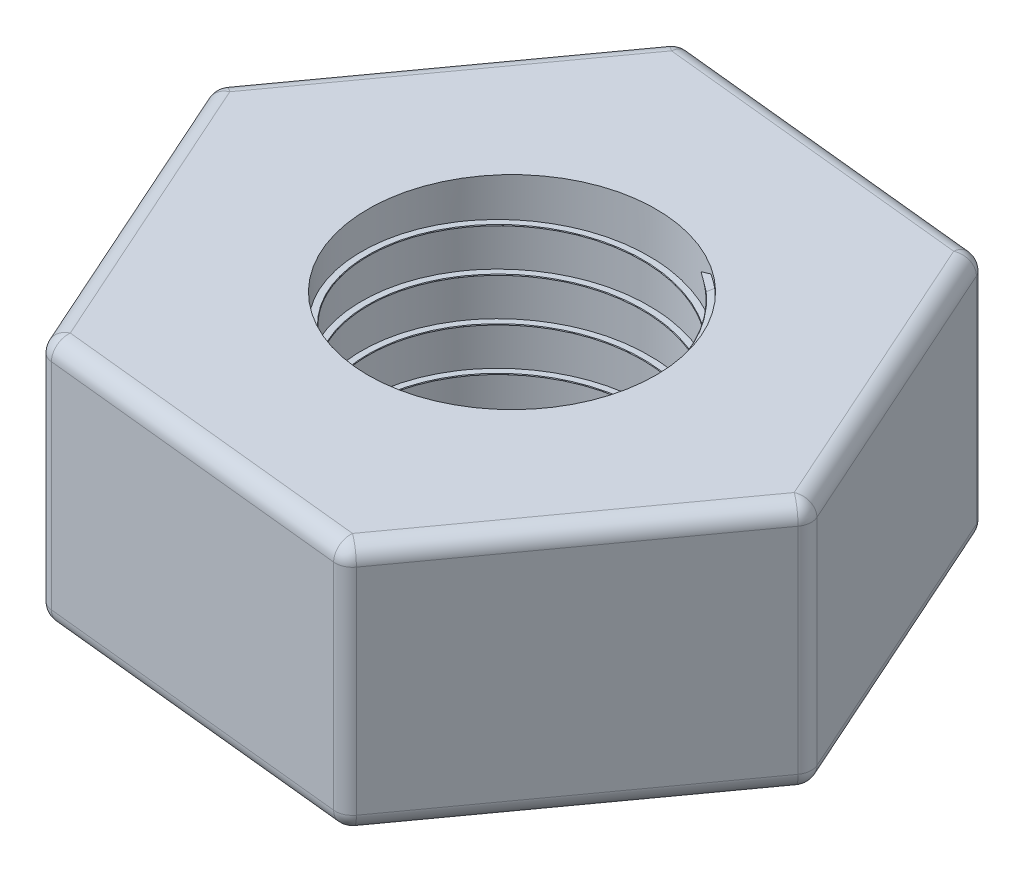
SolidWorks part; units mm, degrees
ref_plane "Front Plane" through (0, 0, 0) normal (0, 0, 1) x (1, 0, 0)
ref_plane "Top Plane" through (0, 0, 0) normal (0, 1, 0) x (1, 0, 0)
ref_plane "Right Plane" through (0, 0, 0) normal (1, 0, 0) x (0, 0, -1)
sketch "Sketch1" plane through (0, 0, 0) normal (0, 1, 0) x (1, 0, 0)
  line L1 (1.6237, -3.6273) -> (3.9532, -0.4075)
  line L2 (3.9532, -0.4075) -> (2.3295, 3.2198)
  line L3 (2.3295, 3.2198) -> (-1.6237, 3.6273)
  line L4 (-1.6237, 3.6273) -> (-3.9532, 0.4075)
  line L5 (-3.9532, 0.4075) -> (-2.3295, -3.2198)
  line L6 (-2.3295, -3.2198) -> (1.6237, -3.6273)
  circle A0 centre (0, 0) radius 3.4417 construction
  circle A1 centre (0, 0) radius 1.7018
  dimension "D2" = 3.4036
  dimension "D1" = 6.8834
extrude "Boss-Extrude1" add sketch "Sketch1" along normal blind 2.9464
sketch "Sketch2" plane through (0, 0, 0) normal (0, -1, 0) x (1, 0, 0)
  circle A2 centre (0, 0) radius 1.9558
  circle A3 centre (0, 0) radius 1.9558
  dimension "D1" = 0.254
curve "Helix/Spiral1"
sketch "Sketch3" plane through (0, 0, 0) normal (0, -1, 0) x (1, 0, 0)
  line L0 (-1.6139, -0.2025) -> (-1.8337, -0.1073)
  line L1 (-1.8337, -0.1073) -> (-1.8337, -0.0441)
  line L2 (-1.8337, -0.0441) -> (-1.6278, 0.0901)
  line L3 (-1.6278, 0.0901) -> (-1.6139, -0.2025)
sweep "Sweep1" add profiles "Sketch3" path "Helix/Spiral1"
fillet "Fillet1" radius 0.2032 18 edges at (0.3529, 2.9464, -3.4236) (3.1414, 2.9464, -1.4061) (2.7884, 2.9464, 2.0174) (-0.3529, 2.9464, 3.4236) (-2.7884, 2.9464, -2.0174) (-3.1414, 2.9464, 1.4061) (-3.1414, 0, 1.4061) (-2.7884, 0, -2.0174) (0.3529, 0, -3.4236) (3.1414, 0, -1.4061) (2.7884, 0, 2.0174) (-0.3529, 0, 3.4236) (2.3295, 1.4732, -3.2198) (-1.6237, 1.4732, -3.6273) (-3.9532, 1.4732, -0.4075) (-2.3295, 1.4732, 3.2198) (1.6237, 1.4732, 3.6273) (3.9532, 1.4732, 0.4075)
